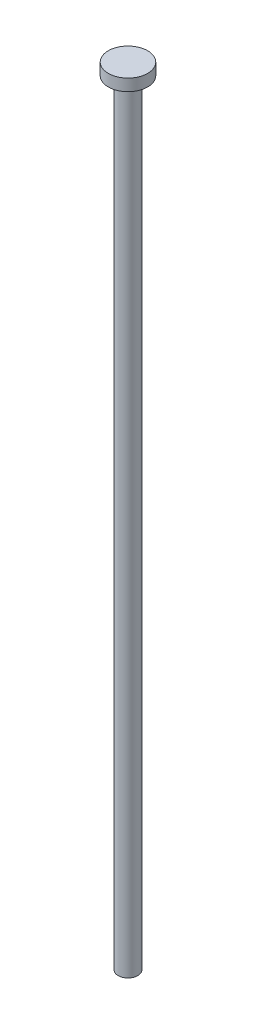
SolidWorks part; units mm, degrees
ref_plane "Front Plane" through (0, 0, 0) normal (0, 0, 1) x (1, 0, 0)
ref_plane "Top Plane" through (0, 0, 0) normal (0, 1, 0) x (1, 0, 0)
ref_plane "Right Plane" through (0, 0, 0) normal (1, 0, 0) x (0, 0, -1)
sketch "PinDia" plane through (0, 0, 0) normal (0, 1, 0) x (1, 0, 0)
  circle A0 centre (0, 0) radius 2.5
  dimension "D1" = 5
extrude "Length" add sketch "PinDia" against normal blind 200
sketch "HeadDia" plane through (0, 0, 0) normal (0, 1, 0) x (1, 0, 0)
  circle A0 centre (0, 0) radius 5
  dimension "D1" = 10
extrude "HeadThickness" add sketch "HeadDia" against normal blind 3
fillet "Fillet1" radius 0.3 1 edges at (0, -3, 2.5)
